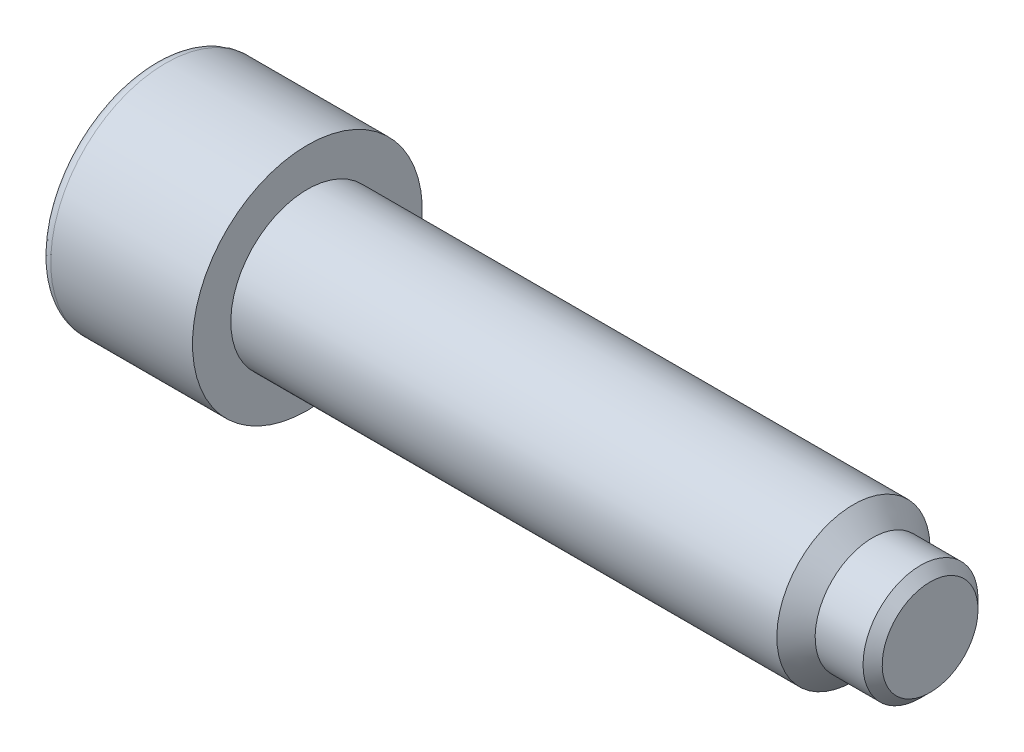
SolidWorks part; units mm, degrees
ref_plane "Plan de face" through (0, 0, 0) normal (0, 0, 1) x (1, 0, 0)
ref_plane "Plan de dessus" through (0, 0, 0) normal (0, 1, 0) x (1, 0, 0)
ref_plane "Plan de droite" through (0, 0, 0) normal (1, 0, 0) x (0, 0, -1)
ref_plane "Plan1" through (0, 0, 0) normal (0, 0, -1) x (-1, 0, 0)
sketch "Esquisse1" plane through (0, 0, 0) normal (0, 0, -1) x (-1, 0, 0)
  line L0 (-91, 6) -> (-91, 0)
  line L1 (-91, 0) -> (-10, 0)
  line L2 (-10, 0) -> (-10, 12)
  line L3 (-10, 12) -> (-26, 12)
  line L4 (-26, 12) -> (-26, 8)
  line L8 (-26, 8) -> (-83, 8)
  line L9 (-91, 0) -> (-10, 0) construction
  line L10 (-83, 8) -> (-85, 6)
  line L11 (-85, 6) -> (-91, 6)
  dimension "D1" = 16
  dimension "D2" = 8
  dimension "D4" = 65
  dimension "D6" = 12
  dimension "D7" = 6
  dimension "D8" = 135
  dimension "D9" = 6
revolve "Révolution1" add sketch "Esquisse1" angle 360 about L9
sketch "Esquisse2" plane through (10, 0, 0) normal (-1, 0, 0) x (0, 0, 1)
  line L0 (-7, -4.0415) -> (0, -8.0829)
  line L1 (0, -8.0829) -> (7, -4.0415)
  line L2 (7, -4.0415) -> (7, 4.0415)
  line L3 (7, 4.0415) -> (0, 8.0829)
  line L4 (0, 8.0829) -> (-7, 4.0415)
  line L5 (-7, 4.0415) -> (-7, -4.0415)
extrude "Empreinte CHc" cut sketch "Esquisse2" against normal blind 8
chamfer "Chanfrein1" distance 1 angle 45 1 edges at (91, -6, 0)
fillet "Congé1" radius 1.2 1 edges at (10, -12, 0)
